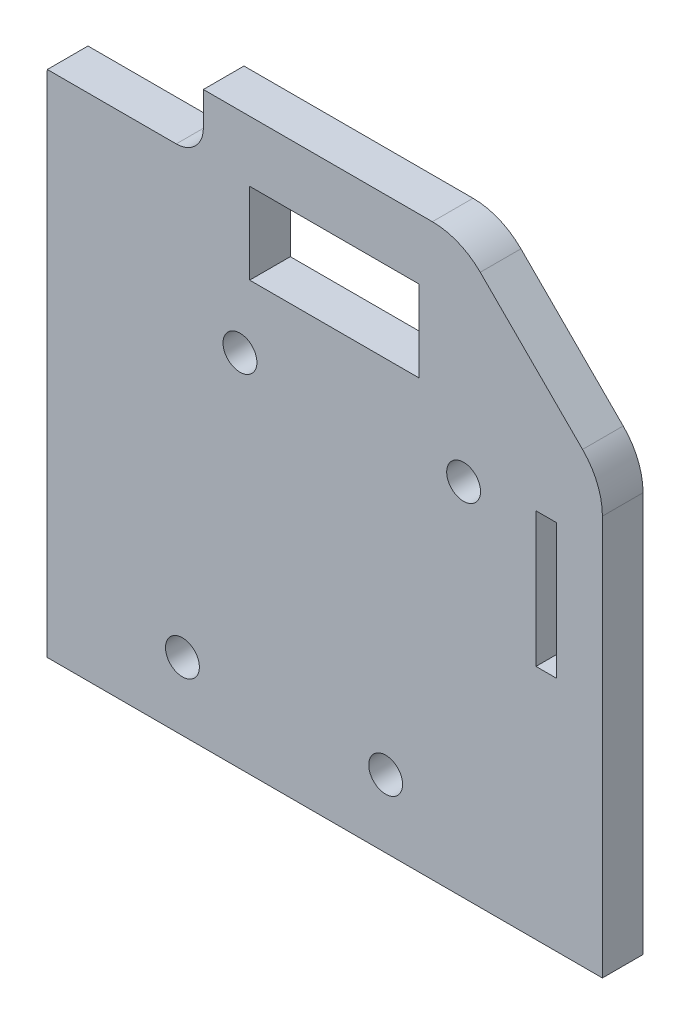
SolidWorks part; units mm, degrees
ref_plane "Front Plane" through (0, 0, 0) normal (0, 0, 1) x (1, 0, 0)
ref_plane "Top Plane" through (0, 0, 0) normal (0, 1, 0) x (1, 0, 0)
ref_plane "Right Plane" through (0, 0, 0) normal (1, 0, 0) x (0, 0, -1)
sketch "Sketch1" plane through (0, 0, 0) normal (0, 0, 1) x (1, 0, 0)
  line L0 (-242.0466, 67.8844) -> (-217.0466, 67.8844)
  line L1 (-217.0466, 67.8844) -> (-217.0466, 55.8844)
  line L2 (-189.9731, 51.7423) -> (-189.9731, -7.3014)
  line L3 (-189.9731, -7.3014) -> (-271.9731, -7.3014)
  line L4 (-271.973, 66.8435) -> (-271.9731, -7.3014)
  line L6 (-261.973, 76.8435) -> (-215.0743, 76.8435)
  line L7 (-192.902, 58.8133) -> (-208.0032, 73.9146)
  line L8 (-217.0466, 55.8844) -> (-242.0466, 55.8844)
  line L9 (-242.0466, 55.8844) -> (-242.0466, 67.8844)
  line L10 (-201.783, 45.727) -> (-198.6427, 45.727) construction
  circle A0 centre (-251.9731, 2.6986) radius 2.5
  circle A1 centre (-221.9713, 2.6986) radius 2.4982
  circle A2 centre (-243.4824, 45.8965) radius 2.5
  circle A3 centre (-210.4638, 45.8965) radius 2.5
  arc A4 (-261.973, 76.8435) -> (-271.973, 66.8435) centre (-261.973, 66.8435) ccw
  arc A5 (-189.9731, 51.7423) -> (-192.902, 58.8133) centre (-199.9731, 51.7423) ccw
  arc A6 (-208.0032, 73.9146) -> (-215.0743, 76.8435) centre (-215.0743, 66.8435) ccw
  dimension "D1" = 10
  dimension "D2" = 10
extrude "Boss-Extrude1" add sketch "Sketch1" along normal blind 6
sketch "Sketch2" plane through (0, 0, 0) normal (0, 0, -1) x (-1, 0, 0)
  line L0 (178.0748, 45.727) -> (198.2801, 47.5801) construction
  line L1 (198.2801, 47.5801) -> (253.1413, 45.727) construction
  line L2 (198.2801, 47.5801) -> (198.2801, 37.5801) construction
  line L3 (198.2801, 37.5801) -> (199.7801, 37.5801) construction
  line L5 (196.7801, 27.6308) -> (199.7801, 27.6308)
  line L6 (196.7801, 27.6308) -> (196.7801, 47.5295)
  line L7 (196.7801, 47.5295) -> (199.7801, 47.5295)
  line L8 (199.7801, 27.6308) -> (199.7801, 47.5295)
  line L9 (196.7801, 27.6308) -> (199.7801, 47.5295) construction
  line L10 (196.7801, 47.5295) -> (199.7801, 27.6308) construction
extrude "Cut-Extrude1" cut sketch "Sketch2" against normal blind 6
sketch "Sketch3" plane through (0, 0, 6) normal (0, 0, 1) x (1, 0, 0)
  line L0 (-271.973, 67.8844) -> (-252.8854, 67.8844)
  line L1 (-248.8854, 76.8435) -> (-271.973, 76.8435)
  line L2 (-248.8854, 71.8844) -> (-248.8854, 76.8435)
  line L3 (-215.0743, 76.8435) -> (-261.973, 76.8435) construction
  line L4 (-271.973, 76.8435) -> (-271.973, 67.8844)
  arc A0 (-252.8854, 67.8844) -> (-248.8854, 71.8844) centre (-252.8854, 71.8844) ccw
  dimension "D1" = 4
extrude "Cut-Extrude2" cut sketch "Sketch3" against normal blind 10
